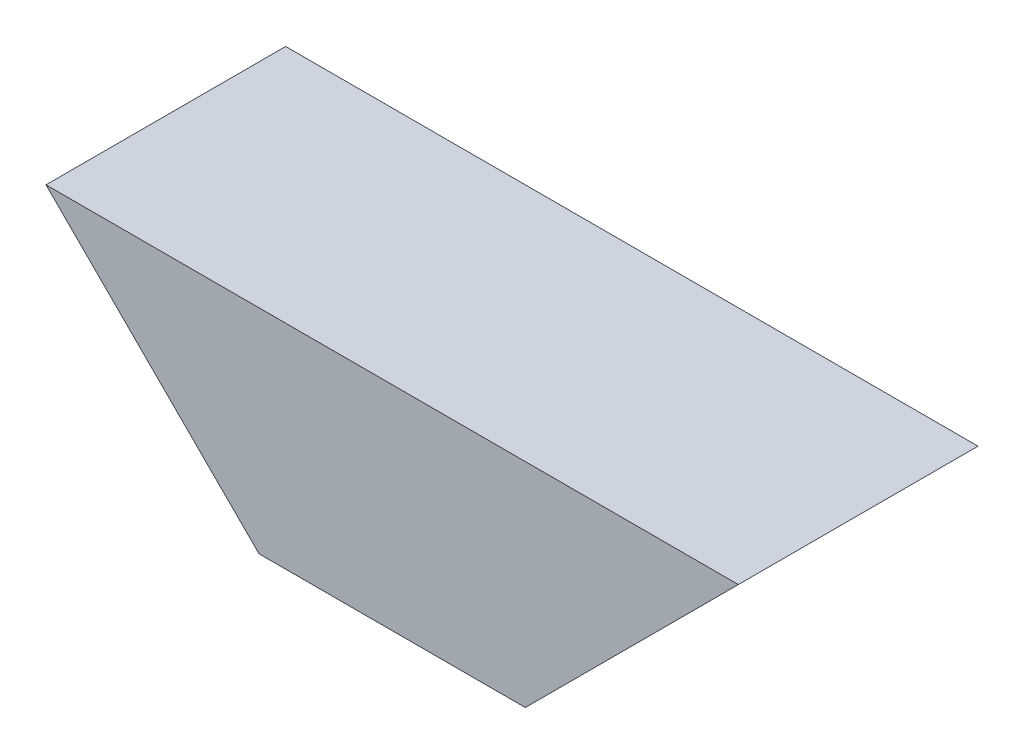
SolidWorks part; units mm, degrees
ref_plane "Front Plane" through (0, 0, 0) normal (0, 0, 1) x (1, 0, 0)
ref_plane "Top Plane" through (0, 0, 0) normal (0, 1, 0) x (1, 0, 0)
ref_plane "Right Plane" through (0, 0, 0) normal (1, 0, 0) x (0, 0, -1)
sketch "Sketch1" plane through (0, 0, 0) normal (0, 0, 1) x (1, 0, 0)
  line L0 (-50, 0) -> (50, 0)
  line L1 (-50, 0) -> (-130, 80)
  line L2 (-130, 80) -> (130, 80)
  line L3 (130, 80) -> (50, 0)
  point P3 (0, 0)
  dimension "D1" = 45
  dimension "D2" = 45
  dimension "D3" = 100
  dimension "D4" = 80
extrude "Boss-Extrude1" add sketch "Sketch1" along normal blind 90
